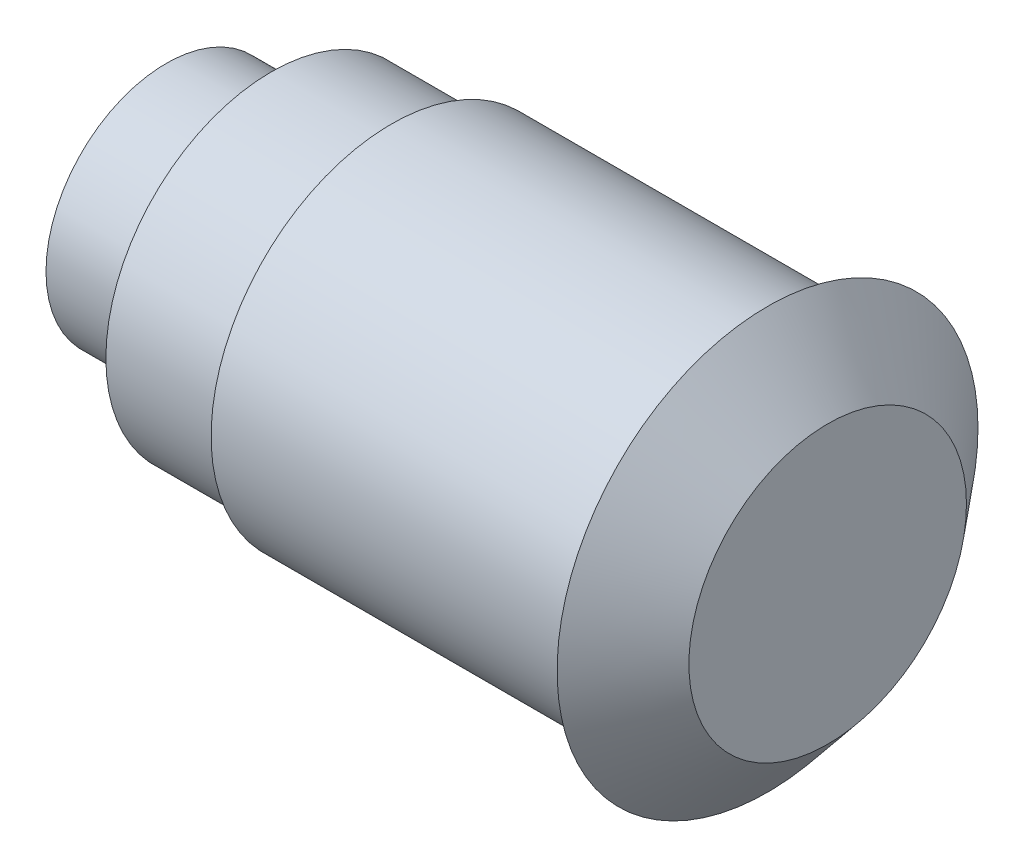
SolidWorks part; units mm, degrees
ref_plane "Plan de face" through (0, 0, 0) normal (0, 0, 1) x (1, 0, 0)
ref_plane "Plan de dessus" through (0, 0, 0) normal (0, 1, 0) x (1, 0, 0)
ref_plane "Plan de droite" through (0, 0, 0) normal (1, 0, 0) x (0, 0, -1)
sketch "Esquisse1" plane through (0, 0, 0) normal (0, 0, 1) x (1, 0, 0)
  line L0 (0, 0) -> (-19.561, 0) construction
  line L1 (2, 0) -> (2, 4.6165)
  line L2 (2, 4.6165) -> (0, 7)
  line L3 (0, 7) -> (0, 6)
  line L4 (0, 6) -> (-12.5084, 6)
  line L5 (-12.5084, 6) -> (-12.7123, 5.5)
  line L6 (-12.7123, 5.5) -> (-16.5084, 5.5)
  line L7 (-16.5084, 5.5) -> (-17.1201, 4)
  line L8 (-17.1201, 4) -> (-20, 4)
  line L9 (-20, 4) -> (-20, 2.8427)
  line L10 (-20, 2.8427) -> (-17.1201, 2.8427)
  line L11 (-17.1201, 2.8427) -> (-17.1201, 0)
  line L12 (-17.1201, 0) -> (2, 0)
  point P8 (-19.561, 0)
  point P16 (-17.1201, 4)
  dimension "D1" = 14
  dimension "D2" = 2
  dimension "D3" = 40
  dimension "D4" = 12
  dimension "D5" = 11
  dimension "D6" = 8
  dimension "D7" = 12.5084
  dimension "D8" = 4
  dimension "D9" = 22
revolve "Révolution1" add sketch "Esquisse1" angle 360 about L0
